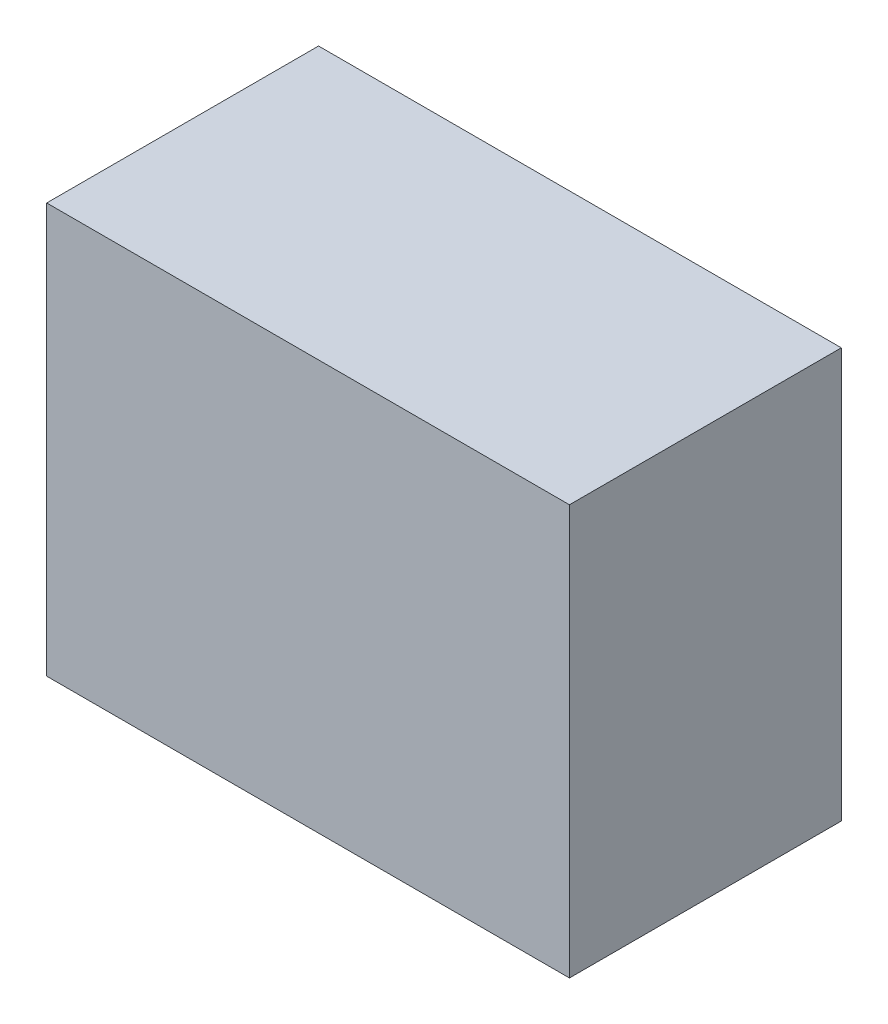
SolidWorks part; units mm, degrees
ref_plane "Front Plane" through (0, 0, 0) normal (0, 0, 1) x (1, 0, 0)
ref_plane "Top Plane" through (0, 0, 0) normal (0, 1, 0) x (1, 0, 0)
ref_plane "Right Plane" through (0, 0, 0) normal (1, 0, 0) x (0, 0, -1)
sketch "Sketch1"
extrude "Extrude1" add sketch "Sketch1" along normal blind 50.8
sketch "Sketch2"
